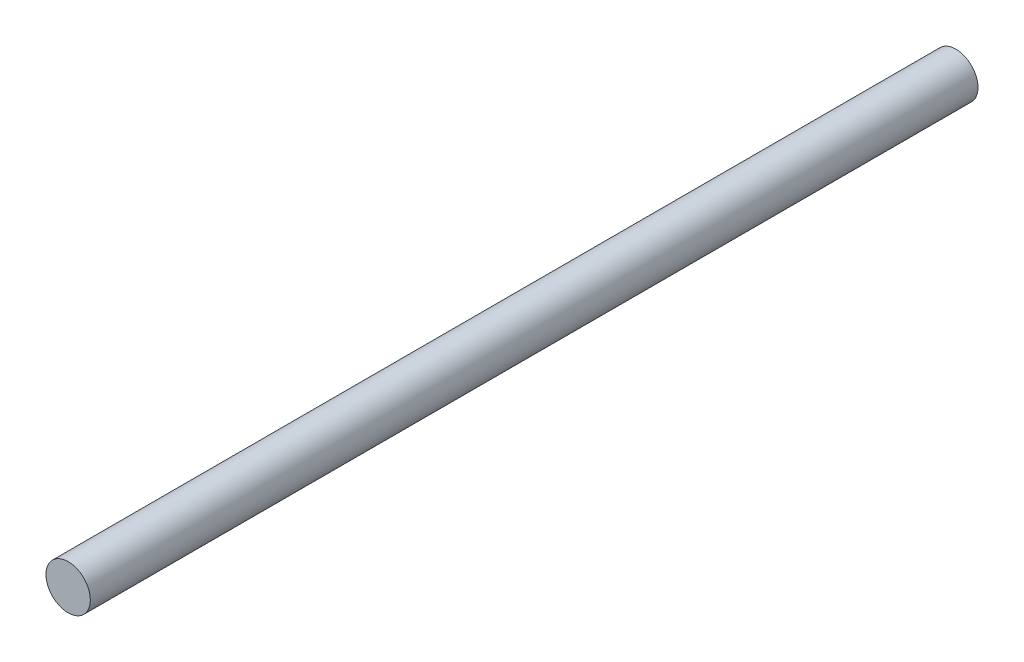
SolidWorks part; units mm, degrees
ref_plane "Front Plane" through (0, 0, 0) normal (0, 0, 1) x (1, 0, 0)
ref_plane "Top Plane" through (0, 0, 0) normal (0, 1, 0) x (1, 0, 0)
ref_plane "Right Plane" through (0, 0, 0) normal (1, 0, 0) x (0, 0, -1)
sketch "Sketch1" plane through (0, 0, 0) normal (0, 0, 1) x (1, 0, 0)
  circle A0 centre (0, 0) radius 30
  dimension "D1" = 60
extrude "Boss-Extrude1" add sketch "Sketch1" against normal blind 1200
